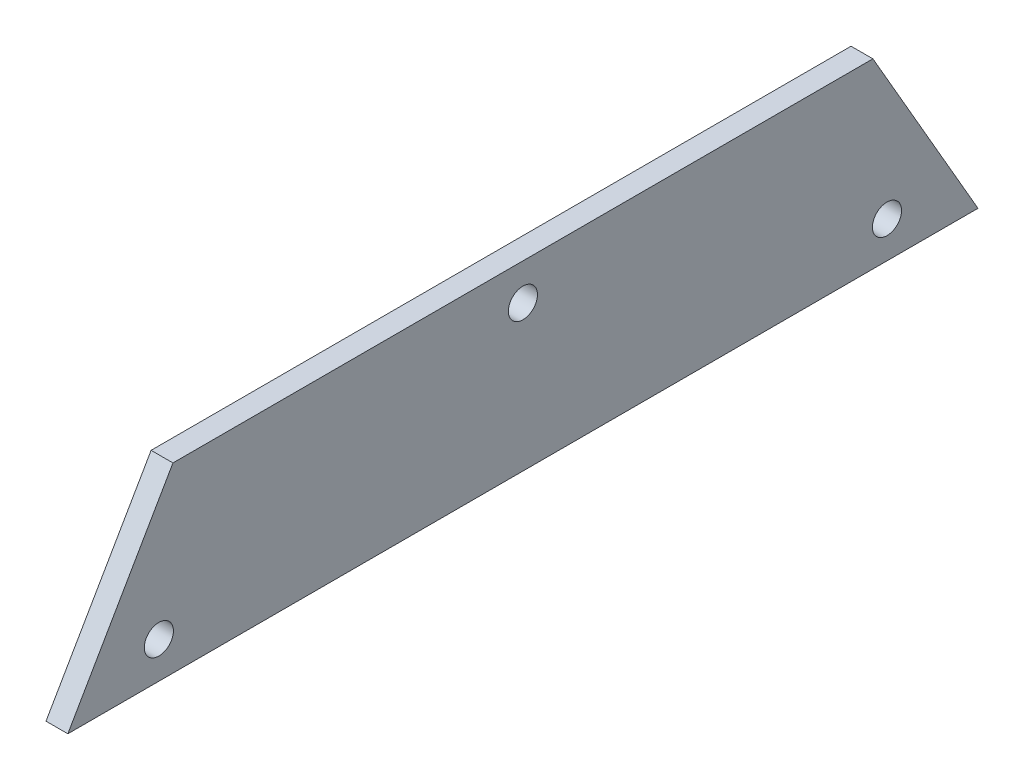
SolidWorks part; units mm, degrees
ref_plane "Front Plane" through (0, 0, 0) normal (0, 0, 1) x (1, 0, 0)
ref_plane "Top Plane" through (0, 0, 0) normal (0, 1, 0) x (1, 0, 0)
ref_plane "Right Plane" through (0, 0, 0) normal (1, 0, 0) x (0, 0, -1)
sketch "Sketch1" plane through (0, 0, 0) normal (1, 0, 0) x (0, 0, -1)
  line L0 (0, 25) -> (0, -25) construction
  line L1 (-150, 25) -> (150, 25)
  line L2 (-150, 25) -> (-150, -25)
  line L3 (-150, -25) -> (150, -25)
  line L4 (150, 25) -> (150, -25)
  line L5 (-150, 0) -> (150, 0) construction
  circle A0 centre (0, 15) radius 4
  circle A1 centre (-100, -15) radius 4
  circle A2 centre (100, -15) radius 4
  dimension "D3" = 8
  dimension "D5" = 8
  dimension "D1" = 50
  dimension "D2" = 300
  dimension "D4" = 10
  dimension "D6" = 100
  dimension "D7" = 10
extrude "Extrude1" add sketch "Sketch1" along normal blind 6
sketch "Sketch2" plane through (6, 0, 0) normal (1, 0, 0) x (0, 0, -1)
  line L0 (-150, 25) -> (-150, -25)
  line L1 (-150, 25) -> (-150, -25) construction
  line L2 (-125, -25) -> (-150, -25)
  line L3 (-150, -25) -> (150, -25) construction
  line L4 (-96.1325, 25) -> (-125, -25)
  line L5 (150, 25) -> (-150, 25) construction
  line L6 (-96.1325, 25) -> (-150, 25)
  line L7 (0, -25) -> (0, 25) construction
  line L8 (96.1325, 25) -> (150, 25)
  line L9 (96.1325, 25) -> (125, -25)
  line L10 (125, -25) -> (150, -25)
  line L11 (150, 25) -> (150, -25)
  dimension "D1" = 120
  dimension "D2" = 25
extrude "Cut-Extrude1" cut sketch "Sketch2" against normal up to next
